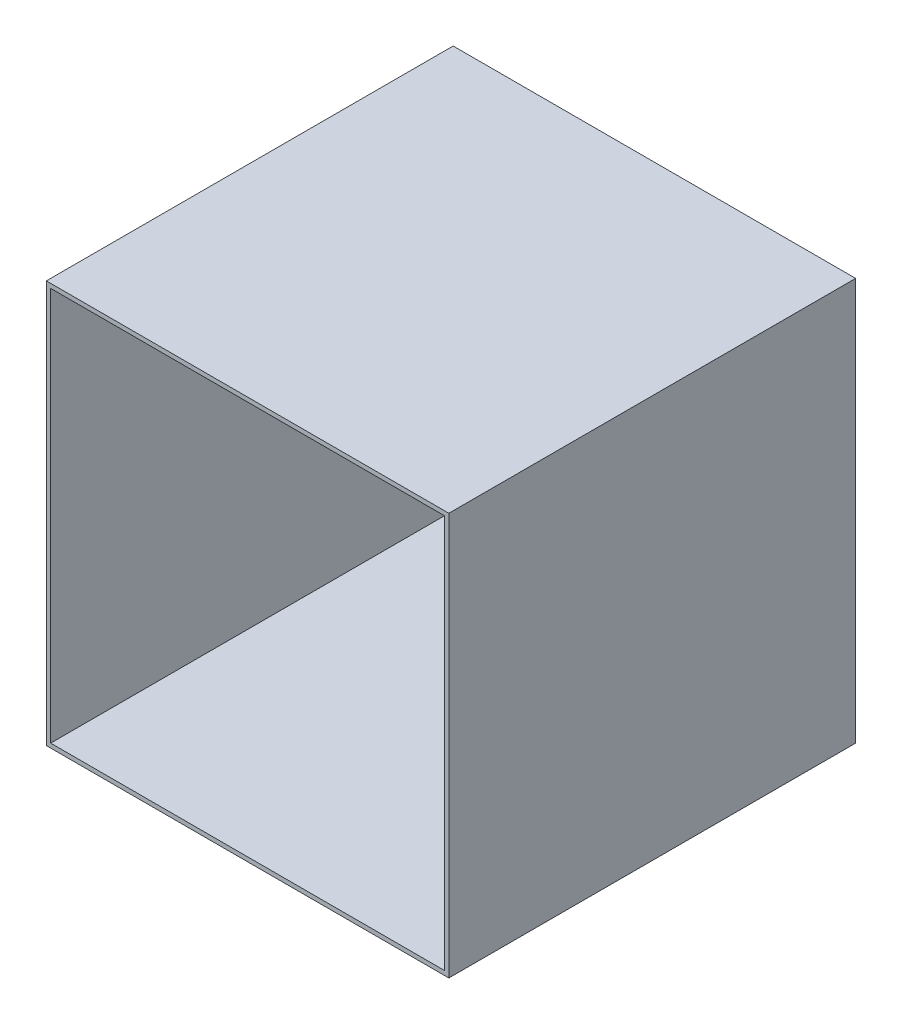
SolidWorks part; units mm, degrees
ref_plane "Front Plane" through (0, 0, 0) normal (1, 0, 0) x (0, 1, 0)
ref_plane "Top Plane" through (0, 0, 0) normal (0, 0, 1) x (0, 1, 0)
ref_plane "Right Plane" through (0, 0, 0) normal (0, 1, 0) x (-1, 0, 0)
sketch "Sketch1" plane through (0, 0, 0) normal (0, 0, 1) x (0, 1, 0)
  line L1 (-139.7, -139.7) -> (139.7, -139.7)
  line L2 (-139.7, -139.7) -> (-139.7, 139.7)
  line L3 (-139.7, 139.7) -> (139.7, 139.7)
  line L4 (139.7, -139.7) -> (139.7, 139.7)
  line L5 (-139.7, -139.7) -> (139.7, 139.7) construction
  line L6 (-139.7, 139.7) -> (139.7, -139.7) construction
  point P0 (0, 0)
  dimension "D1" = 279.4
  dimension "D2" = 279.4
extrude "Boss-Extrude1" add sketch "Sketch1" along normal blind 3
sketch "Sketch2" plane through (0, 0, 3) normal (0, 0, 1) x (1, 0, 0)
  line L1 (-139.7, -139.7) -> (139.7, -139.7)
  line L2 (-139.7, -139.7) -> (-139.7, 139.7)
  line L3 (-139.7, 139.7) -> (139.7, 139.7)
  line L4 (139.7, -139.7) -> (139.7, 139.7)
  line L5 (-139.7, -139.7) -> (139.7, 139.7) construction
  line L6 (-139.7, 139.7) -> (139.7, -139.7) construction
  line L7 (-136.7, -136.7) -> (136.7, -136.7)
  line L8 (-136.7, -136.7) -> (-136.7, 136.7)
  line L9 (-136.7, 136.7) -> (136.7, 136.7)
  line L10 (136.7, -136.7) -> (136.7, 136.7)
  line L11 (-136.7, -136.7) -> (136.7, 136.7) construction
  line L12 (-136.7, 136.7) -> (136.7, -136.7) construction
  point P0 (0, 0)
  point P7 (0, 0)
  dimension "D1" = 3
extrude "Boss-Extrude2" add sketch "Sketch2" along normal blind 279.4
